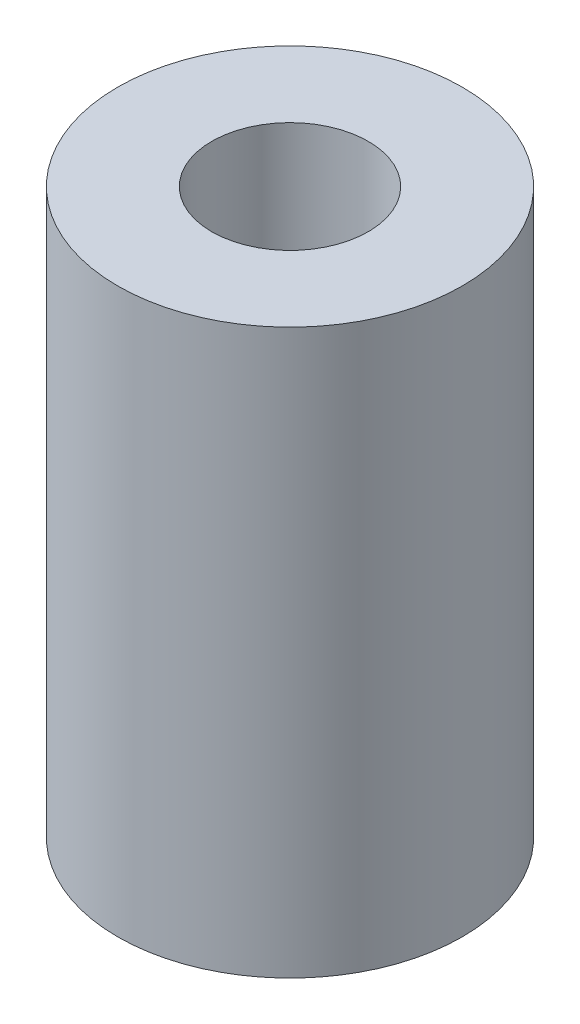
SolidWorks part; units mm, degrees
ref_plane "Front Plane" through (0, 0, 0) normal (0, 0, 1) x (1, 0, 0)
ref_plane "Top Plane" through (0, 0, 0) normal (0, 1, 0) x (1, 0, 0)
ref_plane "Right Plane" through (0, 0, 0) normal (1, 0, 0) x (0, 0, -1)
sketch "Sketch1" plane through (0, 0, 0) normal (0, 1, 0) x (1, 0, 0)
  circle A0 centre (0, 0) radius 5.5
  circle A1 centre (0, 0) radius 2.5
  dimension "D1" = 11
  dimension "D2" = 5
extrude "Boss-Extrude1" add sketch "Sketch1" along normal blind 18
